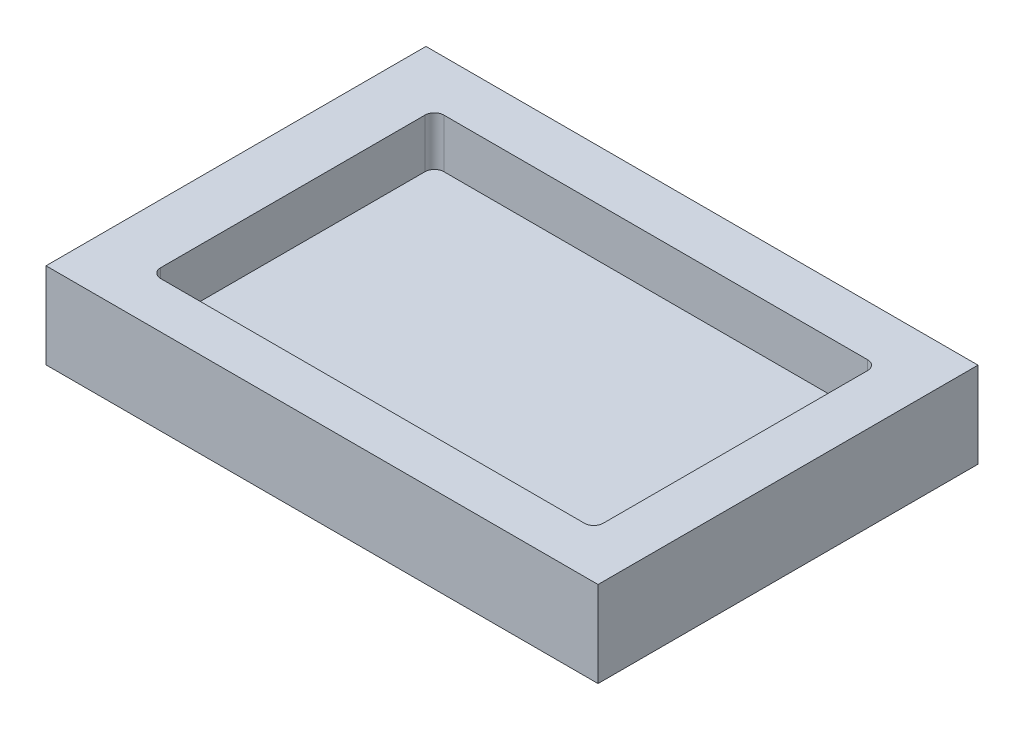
SolidWorks part; units mm, degrees
ref_plane "Front Plane" through (0, 0, 0) normal (0, 0, 1) x (1, 0, 0)
ref_plane "Top Plane" through (0, 0, 0) normal (0, 1, 0) x (1, 0, 0)
ref_plane "Right Plane" through (0, 0, 0) normal (1, 0, 0) x (0, 0, -1)
sketch "Sketch1" plane through (0, 0, 0) normal (0, 1, 0) x (1, 0, 0)
  line L1 (-67.9068, 54.8301) -> (80.754, 54.8301)
  line L2 (-67.9068, 54.8301) -> (-67.9068, -47.4889)
  line L3 (-67.9068, -47.4889) -> (80.754, -47.4889)
  line L4 (80.754, 54.8301) -> (80.754, -47.4889)
extrude "Extrude1" add sketch "Sketch1" along normal blind 23.114
sketch "Sketch2" plane through (0, 23.114, 0) normal (0, 1, 0) x (-1, 0, 0)
  line L1 (-67.168, -41.2287) -> (52.0213, -41.2287)
  line L2 (-67.168, -41.2287) -> (-67.168, 35.0371)
  line L3 (-67.168, 35.0371) -> (52.0213, 35.0371)
  line L4 (52.0213, -41.2287) -> (52.0213, 35.0371)
extrude "Cut-Extrude1" cut sketch "Sketch2" against normal blind 13.208
fillet "Fillet1" radius 2.54 4 edges at (67.168, 16.51, -41.2287) (67.168, 16.51, 35.0371) (-52.0213, 16.51, 35.0371) (-52.0213, 16.51, -41.2287)
